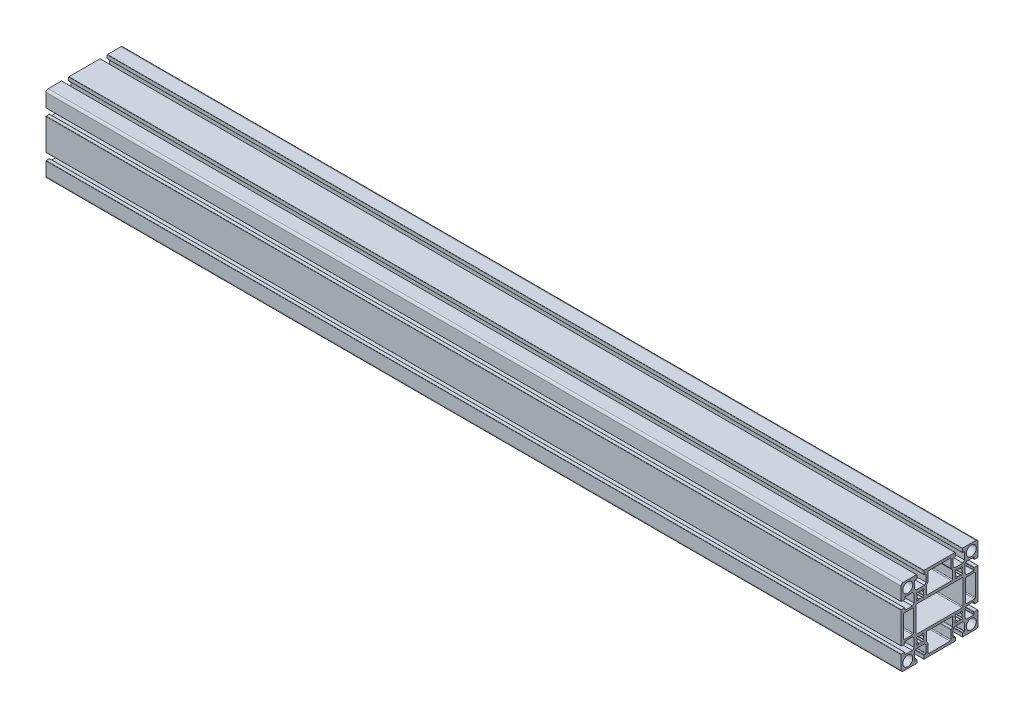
SolidWorks part; units mm, degrees
ref_plane "Front Plane" through (0, 0, 0) normal (0, 0, 1) x (1, 0, 0)
ref_plane "Top Plane" through (0, 0, 0) normal (0, 1, 0) x (1, 0, 0)
ref_plane "Right Plane" through (0, 0, 0) normal (1, 0, 0) x (0, 0, -1)
sketch3d "3DSketch1"
  line L0 (0, 0, 0) -> (1000, 0, 0)
  dimension "D1" = 1000
other "45-sarja 1.0113 90X90 H 6M(1)"
ref_plane "Plane1" through (0, 0, 0) normal (1, 0, 0) x (0, 0, -1)
sketch "Model8" plane through (0, 0, 0) normal (1, 0, 0) x (0, 0, -1)
  line L0 (-13.5, 41) -> (-13.5, 31.2029)
  line L2 (13.5, 31.2029) -> (13.5, 41)
  line L3 (12.5, 42) -> (-12.5, 42)
  line L4 (18.1159, 19.1059) -> (19.1059, 18.1159)
  line L5 (19.5302, 18.1159) -> (20.5509, 19.1367)
  line L6 (24.4491, 19.1367) -> (25.4698, 18.1159)
  line L7 (25.8941, 18.1159) -> (26.8841, 19.1059)
  line L8 (26.8841, 19.5302) -> (25.8633, 20.5509)
  line L9 (25.8633, 24.4491) -> (26.8841, 25.4698)
  line L10 (26.8841, 25.8941) -> (25.8941, 26.8841)
  line L11 (25.4698, 26.8841) -> (24.4491, 25.8633)
  line L12 (20.5509, 25.8633) -> (19.5302, 26.8841)
  line L13 (19.1059, 26.8841) -> (18.1159, 25.8941)
  line L14 (18.1159, 25.4698) -> (19.1367, 24.4491)
  line L15 (19.1367, 20.5509) -> (18.1159, 19.5302)
  line L16 (-26.8841, 19.1059) -> (-25.8941, 18.1159)
  line L17 (-25.4698, 18.1159) -> (-24.4491, 19.1367)
  line L18 (-20.5509, 19.1367) -> (-19.5302, 18.1159)
  line L19 (-19.1059, 18.1159) -> (-18.1159, 19.1059)
  line L20 (-18.1159, 19.5302) -> (-19.1367, 20.5509)
  line L21 (-19.1367, 24.4491) -> (-18.1159, 25.4698)
  line L22 (-18.1159, 25.8941) -> (-19.1059, 26.8841)
  line L23 (-19.5302, 26.8841) -> (-20.5509, 25.8633)
  line L24 (-24.4491, 25.8633) -> (-25.4698, 26.8841)
  line L25 (-25.8941, 26.8841) -> (-26.8841, 25.8941)
  line L26 (-26.8841, 25.4698) -> (-25.8633, 24.4491)
  line L27 (-25.8633, 20.5509) -> (-26.8841, 19.5302)
  line L28 (-27.5, 14.3001) -> (-27.5, -14.3)
  line L29 (-13.7929, 30.4958) -> (-15.0071, 29.2816)
  line L30 (27.5, -14.3) -> (27.5, 14.3001)
  line L31 (15.0071, 29.2816) -> (13.7929, 30.4958)
  line L32 (-42, 12.5) -> (-42, -12.5)
  line L33 (-41, -13.5) -> (-31.5, -13.5)
  line L34 (-30.5, -12.5) -> (-30.5, 12.5)
  line L35 (-31.5, 13.5) -> (-41, 13.5)
  line L36 (30.5, 12.5) -> (30.5, -12.5)
  line L37 (31.5, -13.5) -> (41, -13.5)
  line L38 (42, -12.5) -> (42, 12.5)
  line L39 (41, 13.5) -> (31.5, 13.5)
  line L40 (-13.5, -31.2029) -> (-13.5, -41)
  line L41 (-12.5, -42) -> (12.5, -42)
  line L42 (13.5, -41) -> (13.5, -31.2029)
  line L44 (18.1159, -25.8941) -> (19.1059, -26.8841)
  line L45 (19.5302, -26.8841) -> (20.5509, -25.8633)
  line L46 (24.4491, -25.8633) -> (25.4698, -26.8841)
  line L47 (25.8941, -26.8841) -> (26.8841, -25.8941)
  line L48 (26.8841, -25.4698) -> (25.8633, -24.4491)
  line L49 (25.8633, -20.5509) -> (26.8841, -19.5302)
  line L50 (26.8841, -19.1059) -> (25.8941, -18.1159)
  line L51 (25.4698, -18.1159) -> (24.4491, -19.1367)
  line L52 (20.5509, -19.1367) -> (19.5302, -18.1159)
  line L53 (19.1059, -18.1159) -> (18.1159, -19.1059)
  line L54 (18.1159, -19.5302) -> (19.1367, -20.5509)
  line L55 (19.1367, -24.4491) -> (18.1159, -25.4698)
  line L56 (-26.8841, -25.8941) -> (-25.8941, -26.8841)
  line L57 (-25.4698, -26.8841) -> (-24.4491, -25.8633)
  line L58 (-20.5509, -25.8633) -> (-19.5302, -26.8841)
  line L59 (-19.1059, -26.8841) -> (-18.1159, -25.8941)
  line L60 (-18.1159, -25.4698) -> (-19.1367, -24.4491)
  line L61 (-19.1367, -20.5509) -> (-18.1159, -19.5302)
  line L62 (-18.1159, -19.1059) -> (-19.1059, -18.1159)
  line L63 (-19.5302, -18.1159) -> (-20.5509, -19.1367)
  line L64 (-24.4491, -19.1367) -> (-25.4698, -18.1159)
  line L65 (-25.8941, -18.1159) -> (-26.8841, -19.1059)
  line L66 (-26.8841, -19.5302) -> (-25.8633, -20.5509)
  line L67 (-25.8633, -24.4491) -> (-26.8841, -25.4698)
  line L68 (41, 26.6) -> (44.7, 26.6)
  line L69 (40.5, 29) -> (40.5, 27.1)
  line L70 (31.7, 29.3) -> (40.2, 29.3)
  line L71 (29.7, 27.3) -> (31.7, 29.3)
  line L72 (29.7, 17.7) -> (29.7, 27.3)
  line L73 (31.7, 15.7) -> (29.7, 17.7)
  line L74 (40.2, 15.7) -> (31.7, 15.7)
  line L75 (40.5, 17.9) -> (40.5, 16)
  line L76 (44.7, 18.4) -> (41, 18.4)
  line L77 (45, -18.1) -> (45, 18.1)
  line L78 (41, -18.4) -> (44.7, -18.4)
  line L79 (40.5, -16) -> (40.5, -17.9)
  line L80 (31.7, -15.7) -> (40.2, -15.7)
  line L81 (29.7, -17.7) -> (31.7, -15.7)
  line L82 (29.7, -27.3) -> (29.7, -17.7)
  line L83 (31.7, -29.3) -> (29.7, -27.3)
  line L84 (40.2, -29.3) -> (31.7, -29.3)
  line L85 (40.5, -27.1) -> (40.5, -29)
  line L86 (44.7, -26.6) -> (41, -26.6)
  line L87 (45, -42.5) -> (45, -26.9)
  line L88 (26.9, -45) -> (42.5, -45)
  line L89 (26.6, -41) -> (26.6, -44.7)
  line L90 (29, -40.5) -> (27.1, -40.5)
  line L91 (29.3, -31.7) -> (29.3, -40.2)
  line L92 (27.3, -29.7) -> (29.3, -31.7)
  line L93 (17.7, -29.7) -> (27.3, -29.7)
  line L94 (15.7, -31.7) -> (17.7, -29.7)
  line L95 (15.7, -40.2) -> (15.7, -31.7)
  line L96 (17.9, -40.5) -> (16, -40.5)
  line L97 (18.4, -44.7) -> (18.4, -41)
  line L98 (-18.1, -45) -> (18.1, -45)
  line L99 (-18.4, -41) -> (-18.4, -44.7)
  line L100 (-16, -40.5) -> (-17.9, -40.5)
  line L101 (-15.7, -31.7) -> (-15.7, -40.2)
  line L102 (-17.7, -29.7) -> (-15.7, -31.7)
  line L103 (-27.3, -29.7) -> (-17.7, -29.7)
  line L104 (-29.3, -31.7) -> (-27.3, -29.7)
  line L105 (-29.3, -40.2) -> (-29.3, -31.7)
  line L106 (-27.1, -40.5) -> (-29, -40.5)
  line L107 (-26.6, -44.7) -> (-26.6, -41)
  line L108 (-42.5, -45) -> (-26.9, -45)
  line L109 (-45, -26.9) -> (-45, -42.5)
  line L110 (-41, -26.6) -> (-44.7, -26.6)
  line L111 (-40.5, -29) -> (-40.5, -27.1)
  line L112 (-31.7, -29.3) -> (-40.2, -29.3)
  line L113 (-29.7, -27.3) -> (-31.7, -29.3)
  line L114 (-29.7, -17.7) -> (-29.7, -27.3)
  line L115 (-31.7, -15.7) -> (-29.7, -17.7)
  line L116 (-40.2, -15.7) -> (-31.7, -15.7)
  line L117 (-40.5, -17.9) -> (-40.5, -16)
  line L118 (-44.7, -18.4) -> (-41, -18.4)
  line L119 (-45, 18.1) -> (-45, -18.1)
  line L120 (-41, 18.4) -> (-44.7, 18.4)
  line L121 (-40.5, 16) -> (-40.5, 17.9)
  line L122 (-31.7, 15.7) -> (-40.2, 15.7)
  line L123 (-29.7, 17.7) -> (-31.7, 15.7)
  line L124 (-29.7, 27.3) -> (-29.7, 17.7)
  line L125 (-31.7, 29.3) -> (-29.7, 27.3)
  line L126 (-40.2, 29.3) -> (-31.7, 29.3)
  line L127 (-40.5, 27.1) -> (-40.5, 29)
  line L128 (-44.7, 26.6) -> (-41, 26.6)
  line L129 (-45, 42.5) -> (-45, 26.9)
  line L130 (-26.9, 45) -> (-42.5, 45)
  line L131 (-26.6, 41) -> (-26.6, 44.7)
  line L132 (-29, 40.5) -> (-27.1, 40.5)
  line L133 (-29.3, 31.7) -> (-29.3, 40.2)
  line L134 (-27.3, 29.7) -> (-29.3, 31.7)
  line L135 (-17.7, 29.7) -> (-27.3, 29.7)
  line L136 (-15.7, 31.7) -> (-17.7, 29.7)
  line L137 (-15.7, 40.2) -> (-15.7, 31.7)
  line L138 (-17.9, 40.5) -> (-16, 40.5)
  line L139 (-18.4, 44.7) -> (-18.4, 41)
  line L140 (18.1, 45) -> (-18.1, 45)
  line L141 (18.4, 41) -> (18.4, 44.7)
  line L142 (16, 40.5) -> (17.9, 40.5)
  line L143 (15.7, 31.7) -> (15.7, 40.2)
  line L144 (17.7, 29.7) -> (15.7, 31.7)
  line L145 (27.3, 29.7) -> (17.7, 29.7)
  line L146 (29.3, 31.7) -> (27.3, 29.7)
  line L147 (29.3, 40.2) -> (29.3, 31.7)
  line L148 (27.1, 40.5) -> (29, 40.5)
  line L149 (26.6, 44.7) -> (26.6, 41)
  line L150 (42.5, 45) -> (26.9, 45)
  line L151 (45, 26.9) -> (45, 42.5)
  line L152 (26.5, 15.3001) -> (-26.5, 15.3001)
  line L153 (-26.5, -15.3) -> (26.5, -15.3)
  line L154 (-14.1443, 30.1444) -> (-16.1443, 28.1444) construction
  line L155 (16.1444, 28.1444) -> (14.1444, 30.1444) construction
  line L156 (-15.3, 28.5745) -> (-15.3, 19.3)
  line L157 (15.3, 19.3) -> (15.3, 28.5745)
  line L158 (-15.3, 41) -> (-15.3, 17.5) construction
  line L159 (15.3, 17.5) -> (15.3, 41) construction
  line L160 (-13.5, 41) -> (-13.5, 17.5) construction
  line L161 (-15.3, -19.3) -> (-15.3, -28.5745)
  line L162 (13.5, 17.5) -> (13.5, 41) construction
  line L163 (15.3, -28.5745) -> (15.3, -19.3)
  line L164 (-15.0071, -29.2816) -> (-13.7929, -30.4958)
  line L165 (13.7929, -30.4958) -> (15.0071, -29.2816)
  line L166 (15.3, -41) -> (15.3, -17.5) construction
  line L167 (-15.3, -17.5) -> (-15.3, -41) construction
  line L168 (-16.1443, -28.1444) -> (-14.1443, -30.1444) construction
  line L169 (14.1444, -30.1444) -> (16.1444, -28.1444) construction
  line L170 (-13.5, -17.5) -> (-13.5, -41) construction
  line L171 (13.5, -41) -> (13.5, -17.5) construction
  line L172 (-14.3, 18.3) -> (14.3, 18.3)
  line L173 (14.3, -18.3) -> (-14.3, -18.3)
  arc A0 (-12.5, 42) -> (-13.5, 41) centre (-12.5, 41) ccw
  arc A1 (15.3, 28.5745) -> (15.0071, 29.2816) centre (14.3, 28.5745) ccw
  arc A2 (13.7929, 30.4958) -> (13.5, 31.2029) centre (14.5, 31.2029) cw
  arc A3 (13.5, 41) -> (12.5, 42) centre (12.5, 41) ccw
  circle A4 centre (-37.15, 37.15) radius 5.85
  arc A5 (18.1159, 19.5302) -> (18.1159, 19.1059) centre (18.3281, 19.318) ccw
  arc A6 (19.1059, 18.1159) -> (19.5302, 18.1159) centre (19.318, 18.3281) ccw
  arc A7 (20.8941, 19.1944) -> (20.5509, 19.1367) centre (20.7631, 18.9246) ccw
  arc A8 (20.8941, 19.1944) -> (24.1059, 19.1944) centre (22.5, 22.5) ccw
  arc A9 (24.4491, 19.1367) -> (24.1059, 19.1944) centre (24.2369, 18.9246) ccw
  arc A10 (25.4698, 18.1159) -> (25.8941, 18.1159) centre (25.682, 18.3281) ccw
  arc A11 (26.8841, 19.1059) -> (26.8841, 19.5302) centre (26.6719, 19.318) ccw
  arc A12 (25.8056, 20.8941) -> (25.8633, 20.5509) centre (26.0754, 20.7631) ccw
  arc A13 (25.8056, 20.8941) -> (25.8056, 24.1059) centre (22.5, 22.5) ccw
  arc A14 (25.8633, 24.4491) -> (25.8056, 24.1059) centre (26.0754, 24.2369) ccw
  arc A15 (26.8841, 25.4698) -> (26.8841, 25.8941) centre (26.6719, 25.682) ccw
  arc A16 (25.8941, 26.8841) -> (25.4698, 26.8841) centre (25.682, 26.6719) ccw
  arc A17 (24.1059, 25.8056) -> (24.4491, 25.8633) centre (24.2369, 26.0754) ccw
  arc A18 (24.1059, 25.8056) -> (20.8941, 25.8056) centre (22.5, 22.5) ccw
  arc A19 (20.5509, 25.8633) -> (20.8941, 25.8056) centre (20.7631, 26.0754) ccw
  arc A20 (19.5302, 26.8841) -> (19.1059, 26.8841) centre (19.318, 26.6719) ccw
  arc A21 (18.1159, 25.8941) -> (18.1159, 25.4698) centre (18.3281, 25.682) ccw
  arc A22 (19.1944, 24.1059) -> (19.1367, 24.4491) centre (18.9246, 24.2369) ccw
  arc A23 (19.1944, 24.1059) -> (19.1944, 20.8941) centre (22.5, 22.5) ccw
  arc A24 (19.1367, 20.5509) -> (19.1944, 20.8941) centre (18.9246, 20.7631) ccw
  arc A25 (-26.8841, 19.5302) -> (-26.8841, 19.1059) centre (-26.6719, 19.318) ccw
  arc A26 (-25.8941, 18.1159) -> (-25.4698, 18.1159) centre (-25.682, 18.3281) ccw
  arc A27 (-24.1059, 19.1944) -> (-24.4491, 19.1367) centre (-24.2369, 18.9246) ccw
  arc A28 (-24.1059, 19.1944) -> (-20.8941, 19.1944) centre (-22.5, 22.5) ccw
  arc A29 (-20.5509, 19.1367) -> (-20.8941, 19.1944) centre (-20.7631, 18.9246) ccw
  arc A30 (-19.5302, 18.1159) -> (-19.1059, 18.1159) centre (-19.318, 18.3281) ccw
  arc A31 (-18.1159, 19.1059) -> (-18.1159, 19.5302) centre (-18.3281, 19.318) ccw
  arc A32 (-19.1944, 20.8941) -> (-19.1367, 20.5509) centre (-18.9246, 20.7631) ccw
  arc A33 (-19.1944, 20.8941) -> (-19.1944, 24.1059) centre (-22.5, 22.5) ccw
  arc A34 (-19.1367, 24.4491) -> (-19.1944, 24.1059) centre (-18.9246, 24.2369) ccw
  arc A35 (-18.1159, 25.4698) -> (-18.1159, 25.8941) centre (-18.3281, 25.682) ccw
  arc A36 (-19.1059, 26.8841) -> (-19.5302, 26.8841) centre (-19.318, 26.6719) ccw
  arc A37 (-20.8941, 25.8056) -> (-20.5509, 25.8633) centre (-20.7631, 26.0754) ccw
  arc A38 (-20.8941, 25.8056) -> (-24.1059, 25.8056) centre (-22.5, 22.5) ccw
  arc A39 (-24.4491, 25.8633) -> (-24.1059, 25.8056) centre (-24.2369, 26.0754) ccw
  arc A40 (-25.4698, 26.8841) -> (-25.8941, 26.8841) centre (-25.682, 26.6719) ccw
  arc A41 (-26.8841, 25.8941) -> (-26.8841, 25.4698) centre (-26.6719, 25.682) ccw
  arc A42 (-25.8056, 24.1059) -> (-25.8633, 24.4491) centre (-26.0754, 24.2369) ccw
  arc A43 (-25.8056, 24.1059) -> (-25.8056, 20.8941) centre (-22.5, 22.5) ccw
  arc A44 (-25.8633, 20.5509) -> (-25.8056, 20.8941) centre (-26.0754, 20.7631) ccw
  arc A45 (-26.5, -15.3) -> (-27.5, -14.3) centre (-26.5, -14.3) cw
  arc A46 (26.5, -15.3) -> (27.5, -14.3) centre (26.5, -14.3) ccw
  arc A47 (26.5, 15.3001) -> (27.5, 14.3001) centre (26.5, 14.3001) cw
  arc A48 (-26.5, 15.3001) -> (-27.5, 14.3001) centre (-26.5, 14.3001) ccw
  arc A49 (-41, 13.5) -> (-42, 12.5) centre (-41, 12.5) ccw
  arc A50 (-42, -12.5) -> (-41, -13.5) centre (-41, -12.5) ccw
  arc A51 (-31.5, -13.5) -> (-30.5, -12.5) centre (-31.5, -12.5) ccw
  arc A52 (-30.5, 12.5) -> (-31.5, 13.5) centre (-31.5, 12.5) ccw
  arc A53 (31.5, 13.5) -> (30.5, 12.5) centre (31.5, 12.5) ccw
  arc A54 (30.5, -12.5) -> (31.5, -13.5) centre (31.5, -12.5) ccw
  arc A55 (41, -13.5) -> (42, -12.5) centre (41, -12.5) ccw
  arc A56 (42, 12.5) -> (41, 13.5) centre (41, 12.5) ccw
  arc A58 (-13.5, -41) -> (-12.5, -42) centre (-12.5, -41) ccw
  arc A59 (12.5, -42) -> (13.5, -41) centre (12.5, -41) ccw
  arc A60 (-15.3, -28.5745) -> (-15.0071, -29.2816) centre (-14.3, -28.5745) ccw
  arc A61 (18.1159, -25.4698) -> (18.1159, -25.8941) centre (18.3281, -25.682) ccw
  arc A62 (19.1059, -26.8841) -> (19.5302, -26.8841) centre (19.318, -26.6719) ccw
  arc A63 (20.8941, -25.8056) -> (20.5509, -25.8633) centre (20.7631, -26.0754) ccw
  arc A64 (20.8941, -25.8056) -> (24.1059, -25.8056) centre (22.5, -22.5) ccw
  arc A65 (24.4491, -25.8633) -> (24.1059, -25.8056) centre (24.2369, -26.0754) ccw
  arc A66 (25.4698, -26.8841) -> (25.8941, -26.8841) centre (25.682, -26.6719) ccw
  arc A67 (26.8841, -25.8941) -> (26.8841, -25.4698) centre (26.6719, -25.682) ccw
  arc A68 (25.8056, -24.1059) -> (25.8633, -24.4491) centre (26.0754, -24.2369) ccw
  arc A69 (25.8056, -24.1059) -> (25.8056, -20.8941) centre (22.5, -22.5) ccw
  arc A70 (25.8633, -20.5509) -> (25.8056, -20.8941) centre (26.0754, -20.7631) ccw
  arc A71 (26.8841, -19.5302) -> (26.8841, -19.1059) centre (26.6719, -19.318) ccw
  arc A72 (25.8941, -18.1159) -> (25.4698, -18.1159) centre (25.682, -18.3281) ccw
  arc A73 (24.1059, -19.1944) -> (24.4491, -19.1367) centre (24.2369, -18.9246) ccw
  arc A74 (24.1059, -19.1944) -> (20.8941, -19.1944) centre (22.5, -22.5) ccw
  arc A75 (20.5509, -19.1367) -> (20.8941, -19.1944) centre (20.7631, -18.9246) ccw
  arc A76 (19.5302, -18.1159) -> (19.1059, -18.1159) centre (19.318, -18.3281) ccw
  arc A77 (18.1159, -19.1059) -> (18.1159, -19.5302) centre (18.3281, -19.318) ccw
  arc A78 (19.1944, -20.8941) -> (19.1367, -20.5509) centre (18.9246, -20.7631) ccw
  arc A79 (19.1944, -20.8941) -> (19.1944, -24.1059) centre (22.5, -22.5) ccw
  arc A80 (19.1367, -24.4491) -> (19.1944, -24.1059) centre (18.9246, -24.2369) ccw
  arc A81 (-26.8841, -25.4698) -> (-26.8841, -25.8941) centre (-26.6719, -25.682) ccw
  arc A82 (-25.8941, -26.8841) -> (-25.4698, -26.8841) centre (-25.682, -26.6719) ccw
  arc A83 (-24.1059, -25.8056) -> (-24.4491, -25.8633) centre (-24.2369, -26.0754) ccw
  arc A84 (-24.1059, -25.8056) -> (-20.8941, -25.8056) centre (-22.5, -22.5) ccw
  arc A85 (-20.5509, -25.8633) -> (-20.8941, -25.8056) centre (-20.7631, -26.0754) ccw
  arc A86 (-19.5302, -26.8841) -> (-19.1059, -26.8841) centre (-19.318, -26.6719) ccw
  arc A87 (-18.1159, -25.8941) -> (-18.1159, -25.4698) centre (-18.3281, -25.682) ccw
  arc A88 (-19.1944, -24.1059) -> (-19.1367, -24.4491) centre (-18.9246, -24.2369) ccw
  arc A89 (-19.1944, -24.1059) -> (-19.1944, -20.8941) centre (-22.5, -22.5) ccw
  arc A90 (-19.1367, -20.5509) -> (-19.1944, -20.8941) centre (-18.9246, -20.7631) ccw
  arc A91 (-18.1159, -19.5302) -> (-18.1159, -19.1059) centre (-18.3281, -19.318) ccw
  arc A92 (-19.1059, -18.1159) -> (-19.5302, -18.1159) centre (-19.318, -18.3281) ccw
  arc A93 (-20.8941, -19.1944) -> (-20.5509, -19.1367) centre (-20.7631, -18.9246) ccw
  arc A94 (-20.8941, -19.1944) -> (-24.1059, -19.1944) centre (-22.5, -22.5) ccw
  arc A95 (-24.4491, -19.1367) -> (-24.1059, -19.1944) centre (-24.2369, -18.9246) ccw
  arc A96 (-25.4698, -18.1159) -> (-25.8941, -18.1159) centre (-25.682, -18.3281) ccw
  arc A97 (-26.8841, -19.1059) -> (-26.8841, -19.5302) centre (-26.6719, -19.318) ccw
  arc A98 (-25.8056, -20.8941) -> (-25.8633, -20.5509) centre (-26.0754, -20.7631) ccw
  arc A99 (-25.8056, -20.8941) -> (-25.8056, -24.1059) centre (-22.5, -22.5) ccw
  arc A100 (-25.8633, -24.4491) -> (-25.8056, -24.1059) centre (-26.0754, -24.2369) ccw
  circle A101 centre (-37.15, -37.15) radius 5.85
  arc A102 (40.5, 27.1) -> (41, 26.6) centre (41, 27.1) ccw
  arc A103 (40.5, 29) -> (40.2, 29.3) centre (40.2, 29) ccw
  arc A104 (40.2, 15.7) -> (40.5, 16) centre (40.2, 16) ccw
  arc A105 (41, 18.4) -> (40.5, 17.9) centre (41, 17.9) ccw
  arc A106 (45, 18.1) -> (44.7, 18.4) centre (44.7, 18.1) ccw
  arc A107 (44.7, -18.4) -> (45, -18.1) centre (44.7, -18.1) ccw
  arc A108 (40.5, -17.9) -> (41, -18.4) centre (41, -17.9) ccw
  arc A109 (40.5, -16) -> (40.2, -15.7) centre (40.2, -16) ccw
  arc A110 (40.2, -29.3) -> (40.5, -29) centre (40.2, -29) ccw
  arc A111 (41, -26.6) -> (40.5, -27.1) centre (41, -27.1) ccw
  arc A112 (45, -26.9) -> (44.7, -26.6) centre (44.7, -26.9) ccw
  arc A113 (42.5, -45) -> (45, -42.5) centre (42.5, -42.5) ccw
  arc A114 (26.6, -44.7) -> (26.9, -45) centre (26.9, -44.7) ccw
  arc A115 (27.1, -40.5) -> (26.6, -41) centre (27.1, -41) ccw
  arc A116 (29, -40.5) -> (29.3, -40.2) centre (29, -40.2) ccw
  arc A117 (15.7, -40.2) -> (16, -40.5) centre (16, -40.2) ccw
  arc A118 (18.4, -41) -> (17.9, -40.5) centre (17.9, -41) ccw
  arc A119 (18.1, -45) -> (18.4, -44.7) centre (18.1, -44.7) ccw
  arc A120 (-18.4, -44.7) -> (-18.1, -45) centre (-18.1, -44.7) ccw
  arc A121 (-17.9, -40.5) -> (-18.4, -41) centre (-17.9, -41) ccw
  arc A122 (-16, -40.5) -> (-15.7, -40.2) centre (-16, -40.2) ccw
  arc A123 (-29.3, -40.2) -> (-29, -40.5) centre (-29, -40.2) ccw
  arc A124 (-26.6, -41) -> (-27.1, -40.5) centre (-27.1, -41) ccw
  arc A125 (-26.9, -45) -> (-26.6, -44.7) centre (-26.9, -44.7) ccw
  arc A126 (-45, -42.5) -> (-42.5, -45) centre (-42.5, -42.5) ccw
  arc A127 (-44.7, -26.6) -> (-45, -26.9) centre (-44.7, -26.9) ccw
  arc A128 (-40.5, -27.1) -> (-41, -26.6) centre (-41, -27.1) ccw
  arc A129 (-40.5, -29) -> (-40.2, -29.3) centre (-40.2, -29) ccw
  arc A130 (-40.2, -15.7) -> (-40.5, -16) centre (-40.2, -16) ccw
  arc A131 (-41, -18.4) -> (-40.5, -17.9) centre (-41, -17.9) ccw
  arc A132 (-45, -18.1) -> (-44.7, -18.4) centre (-44.7, -18.1) ccw
  arc A133 (-44.7, 18.4) -> (-45, 18.1) centre (-44.7, 18.1) ccw
  arc A134 (-40.5, 17.9) -> (-41, 18.4) centre (-41, 17.9) ccw
  arc A135 (-40.5, 16) -> (-40.2, 15.7) centre (-40.2, 16) ccw
  arc A136 (-40.2, 29.3) -> (-40.5, 29) centre (-40.2, 29) ccw
  arc A137 (-41, 26.6) -> (-40.5, 27.1) centre (-41, 27.1) ccw
  arc A138 (-45, 26.9) -> (-44.7, 26.6) centre (-44.7, 26.9) ccw
  arc A139 (-42.5, 45) -> (-45, 42.5) centre (-42.5, 42.5) ccw
  arc A140 (-26.6, 44.7) -> (-26.9, 45) centre (-26.9, 44.7) ccw
  arc A141 (-27.1, 40.5) -> (-26.6, 41) centre (-27.1, 41) ccw
  arc A142 (-29, 40.5) -> (-29.3, 40.2) centre (-29, 40.2) ccw
  arc A143 (-15.7, 40.2) -> (-16, 40.5) centre (-16, 40.2) ccw
  arc A144 (-18.4, 41) -> (-17.9, 40.5) centre (-17.9, 41) ccw
  arc A145 (-18.1, 45) -> (-18.4, 44.7) centre (-18.1, 44.7) ccw
  arc A146 (18.4, 44.7) -> (18.1, 45) centre (18.1, 44.7) ccw
  arc A147 (17.9, 40.5) -> (18.4, 41) centre (17.9, 41) ccw
  arc A148 (16, 40.5) -> (15.7, 40.2) centre (16, 40.2) ccw
  arc A149 (29.3, 40.2) -> (29, 40.5) centre (29, 40.2) ccw
  arc A150 (26.6, 41) -> (27.1, 40.5) centre (27.1, 41) ccw
  arc A151 (26.9, 45) -> (26.6, 44.7) centre (26.9, 44.7) ccw
  arc A152 (45, 42.5) -> (42.5, 45) centre (42.5, 42.5) ccw
  arc A153 (44.7, 26.6) -> (45, 26.9) centre (44.7, 26.9) ccw
  circle A154 centre (37.15, -37.15) radius 5.85
  circle A155 centre (37.15, 37.15) radius 5.85
  arc A156 (-13.7929, 30.4958) -> (-13.5, 31.2029) centre (-14.5, 31.2029) ccw
  arc A157 (-15.3, 28.5745) -> (-15.0071, 29.2816) centre (-14.3, 28.5745) cw
  arc A160 (-13.7929, -30.4958) -> (-13.5, -31.2029) centre (-14.5, -31.2029) cw
  arc A161 (13.7929, -30.4958) -> (13.5, -31.2029) centre (14.5, -31.2029) ccw
  arc A162 (15.3, -28.5745) -> (15.0071, -29.2816) centre (14.3, -28.5745) cw
  arc A164 (14.3, 18.3) -> (15.3, 19.3) centre (14.3, 19.3) ccw
  arc A165 (-14.3, 18.3) -> (-15.3, 19.3) centre (-14.3, 19.3) cw
  arc A166 (14.3, -18.3) -> (15.3, -19.3) centre (14.3, -19.3) cw
  arc A167 (-14.3, -18.3) -> (-15.3, -19.3) centre (-14.3, -19.3) ccw
  point P452 (0, 0)
  point P453 (0, 45)
  point P454 (0, -45)
  point P455 (-45, 0)
  point P456 (45, 0)
  point P457 (22.5, 22.5)
  point P458 (-22.5, 22.5)
  point P459 (-22.5, -22.5)
  point P460 (22.5, -22.5)
  point P461 (-45, 45)
  point P462 (45, 45)
  point P463 (-45, -45)
  point P464 (45, -45)
  point P509 (0, 0)
  dimension "D1" = 90
